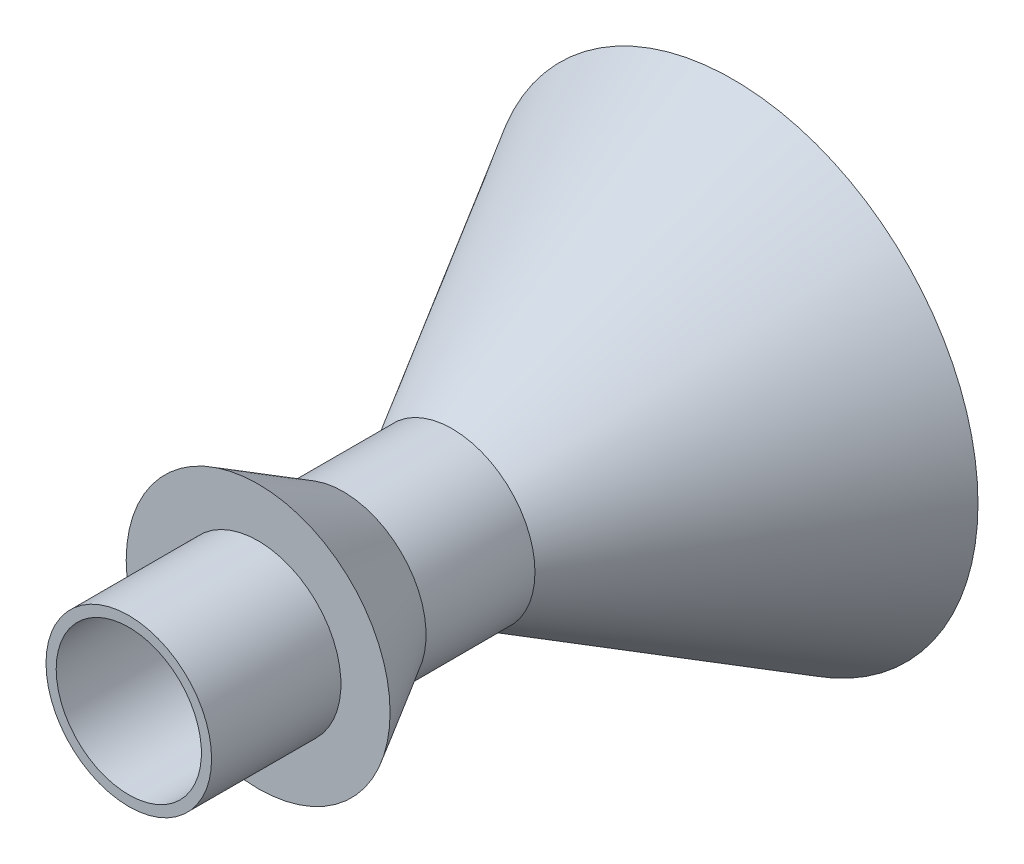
SolidWorks part; units mm, degrees
ref_plane "Front Plane" through (0, 0, 0) normal (0, 0, 1) x (1, 0, 0)
ref_plane "Top Plane" through (0, 0, 0) normal (0, 1, 0) x (1, 0, 0)
ref_plane "Right Plane" through (0, 0, 0) normal (1, 0, 0) x (0, 0, -1)
sketch "Sketch1" plane through (0, 0, 0) normal (0, 0, 1) x (1, 0, 0)
  circle A0 centre (0, 0) radius 16.256
  dimension "D1" = 32.512
extrude "Boss-Extrude1" add sketch "Sketch1" along normal blind 63.5
sketch "Sketch2" plane through (0, 0, 0) normal (0, 1, 0) x (1, 0, 0)
  line L0 (0, 0) -> (-16.256, 0)
  line L1 (-16.256, 0) -> (-49.2516, 57.15)
  line L2 (0, 0) -> (0, 57.15)
  line L3 (0, -63.5) -> (0, 0) construction
  line L4 (-49.2516, 57.15) -> (0, 57.15)
  dimension "D1" = 120
  dimension "D2" = 57.15
revolve "Revolve1" add sketch "Sketch2" angle 360 about axis through (0, 0, 63.5) along (0, 0, -1)
shell "Shell3" thickness 10
sketch "Sketch3" plane through (0, 0, 0) normal (1, 0, 0) x (0, 0, -1)
  line L0 (55.15, -52.8826) -> (57.15, -54.0373)
  line L1 (55.15, 45.7875) -> (55.15, -45.7875) construction
  line L2 (57.15, -49.2516) -> (57.15, 49.2516) construction
  line L3 (57.15, 0) -> (0, 0) construction
  line L4 (57.15, -54.0373) -> (57.15, 0)
  line L5 (55.15, -52.8826) -> (55.15, 0)
  line L6 (55.15, 0) -> (57.15, 0)
  dimension "D1" = 60
  dimension "D2" = 54.0373
revolve "Cut-Revolve1" cut sketch "Sketch3" angle 360 about axis through (0, 0, -57.15) along (0, 0, -1)
sketch "Sketch4" plane through (0, 0, 61.5) normal (0, 0, -1) x (-1, 0, 0)
  circle A0 centre (0, 0) radius 14.256
  circle A1 centre (0, 0) radius 14.256 construction
extrude "Cut-Extrude1" cut sketch "Sketch4" against normal through all
sketch "Sketch5" plane through (0, 0, 0) normal (0, 1, 0) x (1, 0, 0)
  line L4 (-16.256, -38.1) -> (-25.908, -38.1)
  line L5 (-16.256, 0) -> (-16.256, -63.5) construction
  line L6 (-25.908, -38.1) -> (-16.256, -21.3822)
  line L7 (-16.256, -21.3822) -> (-16.256, -38.1)
  line L8 (-16.256, -63.5) -> (16.256, -63.5) construction
  dimension "D1" = 30
  dimension "D2" = 9.652
  dimension "D3" = 25.4
revolve "Revolve2" add sketch "Sketch5" angle 360 about axis through (0, 0, -57.15) along (0, 0, -1)
sketch "Sketch6" plane through (0, 0, 0) normal (1, 0, 0) x (0, 0, -1)
  line L0 (-36.068, 16.306) -> (-25.7845, 16.306)
  line L1 (-36.068, 16.306) -> (-36.068, 22.0014)
  line L2 (-25.7845, 16.306) -> (-36.068, 22.0014)
  point P2 (-25.2796, 16.306)
  point P4 (-36.068, 16.306)
  point P5 (0, 0)
  point P6 (-25.8968, 16.306)
  point P7 (-25.8968, 16.3848)
  point P8 (-25.7845, 16.306)
  point P9 (-38.1, 16.256)
  point P10 (0, 0)
  point P11 (-36.068, 22.0014)
  point P12 (0, 0)
  point P13 (0, 0)
revolve "Cut-Revolve2" cut sketch "Sketch6" angle 360 about axis through (0, 0, 63.5) along (0, 0, -1)
